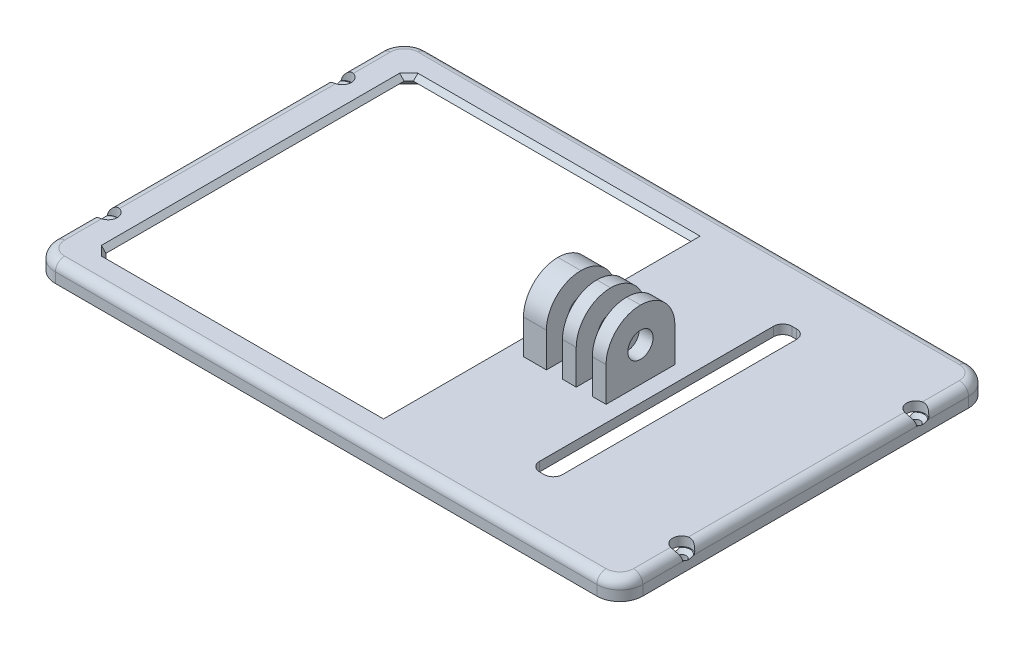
SolidWorks part; units mm, degrees
ref_plane "Plan de face" through (0, 0, 0) normal (0, 0, 1) x (1, 0, 0)
ref_plane "Plan de dessus" through (0, 0, 0) normal (0, 1, 0) x (1, 0, 0)
ref_plane "Plan de droite" through (0, 0, 0) normal (1, 0, 0) x (0, 0, -1)
sketch "Esquisse1" plane through (0, 0, 0) normal (0, 1, 0) x (1, 0, 0)
  line L0 (0, 0) -> (0, 18.4763) construction
  line L1 (-64, -40.5) -> (64, -40.5)
  line L2 (-64, -40.5) -> (-64, 40.5)
  line L3 (-64, 40.5) -> (64, 40.5)
  line L4 (64, -40.5) -> (64, 40.5)
  line L5 (0, 0) -> (-13.3082, 0) construction
  line L7 (-61, -38.5) -> (61, -38.5)
  line L8 (-61, -38.5) -> (-61, 38.5)
  line L9 (-61, 38.5) -> (61, 38.5)
  line L10 (61, -38.5) -> (61, 38.5)
  dimension "D1" = 81
  dimension "D2" = 128
  dimension "D3" = 2
  dimension "D4" = 3
extrude "Boss.-Extru.1" add sketch "Esquisse1" along normal blind 4.2
fillet "Congé1" radius 5 4 edges at (64, 2.1, 40.5) (64, 2.1, -40.5) (-64, 2.1, -40.5) (-64, 2.1, 40.5)
sketch "Esquisse2" plane through (0, 0, 38.5) normal (0, 0, -1) x (-1, 0, 0)
  line L1 (-61, 4.2) -> (-6.5, 4.2)
  line L2 (-61, 4.2) -> (-61, 2.2)
  line L3 (-61, 2.2) -> (-6.5, 2.2)
  line L4 (-6.5, 4.2) -> (-6.5, 2.2)
  dimension "D1" = 54.5
  dimension "D2" = 2
extrude "Boss.-Extru.2" add sketch "Esquisse2" along normal up to next
sketch "Esquisse3" plane through (0, 4.2, 0) normal (0, 1, 0) x (1, 0, 0)
  line L0 (64, -35.5) -> (64, 35.5) construction
  line L1 (36.5, 27.5) -> (31.5, 27.5)
  line L2 (36.5, 27.5) -> (36.5, -27.5)
  line L3 (36.5, -27.5) -> (31.5, -27.5)
  line L4 (31.5, 27.5) -> (31.5, -27.5)
  line L7 (0, 0) -> (9.2914, 0) construction
  dimension "D1" = 27.5
  dimension "D2" = 55
  dimension "D3" = 5
extrude "Enlèv. mat.-Extru.1" cut sketch "Esquisse3" against normal up to next
fillet "Congé2" radius 2 4 edges at (36.5, 3.2, 27.5) (36.5, 3.2, -27.5) (31.5, 3.2, -27.5) (31.5, 3.2, 27.5)
sketch "Esquisse11" plane through (6.5, 0, 0) normal (-1, 0, 0) x (0, 0, 1)
  line L0 (-38.5, 2.2) -> (38.5, 2.2) construction
  line L1 (38.5, 4.2) -> (33.5, 4.2)
  line L2 (38.5, 4.2) -> (38.5, 2.2)
  line L3 (38.5, 2.2) -> (33.5, 2.2)
  line L4 (33.5, 4.2) -> (33.5, 2.2)
  dimension "D1" = 5
extrude "Boss.-Extru.4" add sketch "Esquisse11" along normal up to next
sketch "Esquisse13" plane through (0, 0, 33.5) normal (0, 0, -1) x (-1, 0, 0)
  line L0 (61, 4.2) -> (-6.5, 4.2) construction
  line L1 (61, 2.2) -> (56, 2.2)
  line L2 (61, 2.2) -> (61, 4.2)
  line L3 (61, 4.2) -> (56, 4.2)
  line L4 (56, 2.2) -> (56, 4.2)
  dimension "D1" = 5
extrude "Boss.-Extru.5" add sketch "Esquisse13" along normal up to next
sketch "Esquisse14" plane through (-56, 0, 0) normal (1, 0, 0) x (0, 0, -1)
  line L0 (38.5, 4.2) -> (-33.5, 4.2) construction
  line L1 (38.5, 2.2) -> (33.5, 2.2)
  line L2 (38.5, 2.2) -> (38.5, 4.2)
  line L3 (38.5, 4.2) -> (33.5, 4.2)
  line L4 (33.5, 2.2) -> (33.5, 4.2)
  dimension "D1" = 5
extrude "Boss.-Extru.6" add sketch "Esquisse14" along normal up to next
sketch "Esquisse15" plane through (0, 0, -38.5) normal (0, 0, 1) x (1, 0, 0)
  line L0 (-61, 2.2) -> (-58.5, 2.2) construction
  line L1 (-61, 2.2) -> (61, 2.2) construction
  line L2 (-61, 2.2) -> (-61, -0.3) construction
  line L3 (-60.7, 0) -> (-58.5, 2.2)
  line L4 (-58.5, 2.2) -> (-61, 2.2)
  line L5 (-61, 2.2) -> (-61, 0)
  line L6 (-61, 0) -> (-60.7, 0)
  line L7 (61, 0) -> (-61, 0) construction
  line L8 (6.5, 2.2) -> (6.5, -0.3) construction
  line L9 (61, 2.2) -> (61, 0) construction
  line L10 (6.5, 2.2) -> (4, 2.2) construction
  line L11 (4, 2.2) -> (6.2, 0)
  line L12 (4, 2.2) -> (-58.5, 2.2)
  line L13 (-60.7, 0) -> (6.2, 0)
  line L14 (-58.5, 2.2) -> (-60.7, 0)
  line L15 (6.2, 0) -> (4, 2.2)
  line L16 (-58.5, 2.2) -> (-60.7, 0)
  line L17 (-58.5, 2.2) -> (4, 2.2)
  line L18 (6.2, 0) -> (-60.7, 0)
  dimension "D1" = 2.5
  dimension "D2" = 2.5
  dimension "D3" = 54.5
  dimension "D4" = 2.5
  dimension "D5" = 2.5
extrude "Enlèv. mat.-Extru.6" cut sketch "Esquisse15" against normal blind 4.2 contours L11 L3 M7 M9
sketch "Esquisse20" plane through (0, 4.2, 0) normal (0, 1, 0) x (1, 0, 0)
  line L0 (0, 0) -> (0, 12.7978) construction
  line L1 (0, 0) -> (-4.9006, 0) construction
  line L2 (64, -35.5) -> (64, 35.5) construction
  line L3 (59, 40.5) -> (-59, 40.5) construction
  circle A0 centre (62.5, 25.5) radius 1
  circle A1 centre (62.5, -25.5) radius 1
  circle A2 centre (-62.5, -25.5) radius 1
  circle A3 centre (-62.5, 25.5) radius 1
  dimension "D1" = 2
  dimension "D2" = 1.5
  dimension "D3" = 15
extrude "Enlèv. mat.-Extru.7" cut sketch "Esquisse20" against normal through all
sketch "Esquisse21" plane through (0, 4.2, 0) normal (0, 1, 0) x (1, 0, 0)
  circle A0 centre (-62.5, -25.5) radius 2
  dimension "D1" = 4
extrude "Enlèv. mat.-Extru.8" cut sketch "Esquisse21" against normal blind 2
fillet "Congé4" radius 2 2 edges at (-61, 2.2, -7.1614) (-61, 2.2, 32.6614)
fillet "Congé5" radius 0.8 1 edges at (-62.5, 2.2, 26.5)
sketch "Esquisse22" plane through (0, 4.2, 0) normal (0, 1, 0) x (1, 0, 0)
  circle A0 centre (-62.5, 25.5) radius 2
  circle A1 centre (62.5, 25.5) radius 2
  circle A2 centre (62.5, -25.5) radius 2
  dimension "D1" = 4
extrude "Enlèv. mat.-Extru.10" cut sketch "Esquisse22" against normal blind 2
chamfer "Chanfrein2" distance 0.8 angle 45 3 edges at (-62.5, 2.2, -24.5) (62.5, 2.2, 26.5) (62.5, 2.2, -24.5)
chamfer "Chanfrein3" distance 1 angle 45 7 edges at (-24.75, 4.2, 33.5) (-24.75, 4.2, -33.5) (-56, 2.2, 0) (-56, 4.2, 0) (-24.75, 2.2, 33.5) (-24.75, 2.2, -33.5) (6.5, 2.2, 0)
fillet "Congé6" radius 2 12 edges at (62.5355, 4.2, -39.0355) (-62.5355, 4.2, -39.0355) (-64, 4.2, 31.1614) (-62.5355, 4.2, 39.0355) (64, 4.2, 31.1614) (62.5355, 4.2, 39.0355) (64, 4.2, 0) (64, 4.2, -31.1614) (0, 4.2, -40.5) (-64, 4.2, -31.1614) (-64, 4.2, 0) (0, 4.2, 40.5)
sketch "Esquisse23" plane through (0, 4.2, 0) normal (0, 1, 0) x (1, 0, 0)
  line L0 (0, 0) -> (-4.9372, 0) construction
  line L1 (10, 7.5) -> (15, 7.5)
  line L2 (10, 7.5) -> (10, -7.5)
  line L3 (10, -7.5) -> (15, -7.5)
  line L4 (15, 7.5) -> (15, -7.5)
  line L5 (6.5, 34.5) -> (6.5, -34.5) construction
  line L6 (18.5, 7.5) -> (21.5, 7.5)
  line L7 (18.5, 7.5) -> (18.5, -7.5)
  line L8 (18.5, -7.5) -> (21.5, -7.5)
  line L9 (21.5, 7.5) -> (21.5, -7.5)
  line L10 (25, 7.5) -> (28, 7.5)
  line L11 (25, 7.5) -> (25, -7.5)
  line L12 (25, -7.5) -> (28, -7.5)
  line L13 (28, 7.5) -> (28, -7.5)
  dimension "D1" = 5
  dimension "D2" = 3.5
  dimension "D3" = 15
  dimension "D4" = 15
  dimension "D5" = 15
  dimension "D6" = 3
  dimension "D7" = 3.5
  dimension "D8" = 3
  dimension "D9" = 3.5
extrude "Boss.-Extru.12" add sketch "Esquisse23" along normal blind 15
fillet "Congé7" radius 7.5 6 edges at (12.5, 19.2, 7.5) (20, 19.2, 7.5) (26.5, 19.2, 7.5) (26.5, 19.2, -7.5) (20, 19.2, -7.5) (12.5, 19.2, -7.5)
sketch "Esquisse24" plane through (10, 0, 0) normal (-1, 0, 0) x (0, 0, 1)
  line L0 (-7.5, 11.7) -> (-7.5, 4.2) construction
  circle A0 centre (0, 11.7) radius 2.75
  dimension "D1" = 5.5
  dimension "D2" = 7.5
  dimension "D3" = 7.5
extrude "Enlèv. mat.-Extru.11" cut sketch "Esquisse24" against normal through all
sketch "Esquisse29" plane through (10, 0, 0) normal (-1, 0, 0) x (0, 0, 1)
  line L1 (4.75, 11.7) -> (2.375, 15.8136)
  line L2 (2.375, 15.8136) -> (-2.375, 15.8136)
  line L3 (-2.375, 15.8136) -> (-4.75, 11.7)
  line L4 (-4.75, 11.7) -> (-2.375, 7.5864)
  line L5 (-2.375, 7.5864) -> (2.375, 7.5864)
  line L6 (2.375, 7.5864) -> (4.75, 11.7)
  circle A0 centre (0, 11.7) radius 4.1136 construction
  dimension "D1" = 9.5
extrude "Enlèv. mat.-Extru.14" cut sketch "Esquisse29" against normal blind 4
